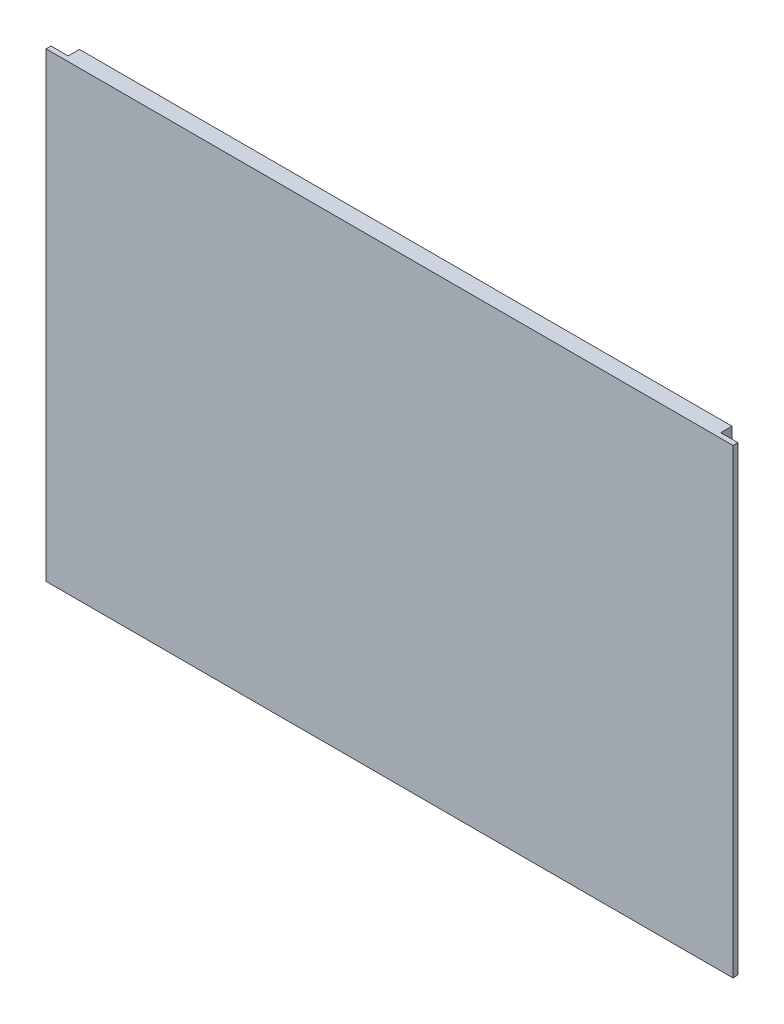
SolidWorks part; units mm, degrees
ref_plane "Ön Düzlem" through (0, 0, 0) normal (0, 0, 1) x (1, 0, 0)
ref_plane "Üst Düzlem" through (0, 0, 0) normal (0, 1, 0) x (1, 0, 0)
ref_plane "Sağ Düzlem" through (0, 0, 0) normal (1, 0, 0) x (0, 0, -1)
sketch "Çizim5" plane through (0, 0, 0) normal (0, 0, 1) x (1, 0, 0)
  line L1 (-78.6957, 40.8696) -> (61.3043, 40.8696)
  line L2 (-78.6957, 40.8696) -> (-78.6957, -53.1304)
  line L3 (-78.6957, -53.1304) -> (61.3043, -53.1304)
  line L4 (61.3043, 40.8696) -> (61.3043, -53.1304)
  dimension "D1" = 140
  dimension "D2" = 94
extrude "Yükseklik-Ekstrüzyon5" add sketch "Çizim5" against normal blind 1
sketch "Çizim7" plane through (-78.6957, 0, 0) normal (-1, 0, 0) x (0, 0, 1)
  line L5 (-1, -53.0304) -> (-3.3, -52.5304)
  line L6 (-1, 40.8696) -> (-1, -53.1304) construction
  line L7 (-3.3, -52.5304) -> (-3.3, -50.0304)
  line L8 (-3.3, -50.0304) -> (-1, -49.5304)
  line L9 (-1, -49.5304) -> (-1, -53.0304)
  line L10 (0, 40.8696) -> (0, -53.1304) construction
  dimension "D1" = 3.3
  dimension "D2" = 2.5
  dimension "D3" = 0.5
  dimension "D4" = 3.5
  dimension "D5" = 0.1
extrude "Yükseklik-Ekstrüzyon6" add sketch "Çizim7" against normal up to surface (140 mm away)
pattern_linear "LÇoğaltma1" count 16 spacing 6 along (0, 1, 0) of "Yükseklik-Ekstrüzyon6"
sketch "Çizim11" plane through (-78.6957, 0, 0) normal (-1, 0, 0) x (0, 0, 1)
  line L0 (0, 40.8696) -> (-3.3, 40.8696)
  line L1 (-3.3, 39.9696) -> (-3.3, 40.8696)
  line L2 (-3.3, 39.9696) -> (0, 39.9696)
  line L3 (0, 40.8696) -> (0, -53.1304) construction
  line L4 (0, 39.9696) -> (0, 40.8696)
extrude "Yükseklik-Ekstrüzyon7" add sketch "Çizim11" against normal up to surface (140 mm away)
sketch "Çizim12" plane through (-78.6957, 0, 0) normal (-1, 0, 0) x (0, 0, 1)
sketch "Çizim13" plane through (-78.6957, 0, 0) normal (-1, 0, 0) x (0, 0, 1)
  line L0 (-1, -53.0304) -> (1.243, -53.4093)
  line L2 (1.243, -53.4093) -> (-0.849, -53.5229)
  line L3 (-0.849, -53.5229) -> (-1, -53.0304)
extrude "Kes-Ekstrüzyon4" cut sketch "Çizim13" against normal up to surface (140 mm away)
sketch "Çizim14" plane through (-78.6957, 0, 0) normal (-1, 0, 0) x (0, 0, 1)
  line L0 (-3.3, 33.9696) -> (-7.4468, 33.9696)
  line L2 (-9.5, 33.4696) -> (-9.5, 32.4696)
  line L3 (-3.3, 31.4696) -> (-3.3, 33.9696)
  spline S0 degree 2 poles (-3.3, 31.4696) (-6.4753, 31.4753) (-9.5, 32.4696) knots 0 0 0 1 1 1
  spline S1 degree 2 poles (-9.5, 33.4696) (-8.5223, 33.9266) (-7.4468, 33.9696) knots 0 0 0 1 1 1
  dimension "D1" = 1
extrude "Yükseklik-Ekstrüzyon8" add sketch "Çizim14" against normal up to surface (140 mm away)
sketch "Çizim15" plane through (0, 33.9696, 0) normal (0, 1, 0) x (1, 0, 0)
  line L0 (-78.6957, 3.3) -> (-74.6957, 3.3)
  line L1 (61.3043, 3.3) -> (-78.6957, 3.3) construction
  line L8 (-78.6957, 9.5) -> (-62.6957, 9.5)
  line L9 (61.3043, 9.5) -> (-78.6957, 9.5) construction
  line L10 (-78.6957, 9.5) -> (-78.6957, 3.3)
  line L13 (61.3043, 2.8) -> (57.3043, 2.8)
  line L14 (61.3043, 9.5) -> (61.3043, 2.8)
  line L15 (61.3043, 9.5) -> (45.3043, 9.5)
  spline S0 degree 2 poles (-74.6957, 3.3) (-69.5753, 8.0052) (-62.6957, 9.5) knots 0 0 0 1 1 1
  spline S1 degree 2 poles (57.3043, 2.8) (52.4996, 8.1646) (45.3043, 9.5) knots 0 0 0 1 1 1
  dimension "D1" = 4
  dimension "D2" = 16
extrude "Kes-Ekstrüzyon7" cut sketch "Çizim15" against normal blind 3
sketch "Çizim17" plane through (0, 0, -3.3) normal (0, 0, -1) x (-1, 0, 0)
  line L0 (-61.3043, 40.8696) -> (-61.3043, -53.1304)
  line L1 (-61.3043, -53.1304) -> (-57.8043, -53.1304)
  line L2 (-61.3043, -53.1304) -> (78.6957, -53.1304) construction
  line L3 (-57.8043, -53.1304) -> (-57.8043, 44.5371)
  line L4 (-57.8043, 44.5371) -> (-61.3043, 44.5371)
  line L5 (-61.3043, 44.5371) -> (-61.3043, 40.8696)
  line L8 (78.6957, 44.5371) -> (78.6957, 40.8696)
  line L9 (75.1957, 44.5371) -> (78.6957, 44.5371)
  line L10 (75.1957, -53.1304) -> (75.1957, 44.5371)
  line L11 (78.6957, -53.1304) -> (75.1957, -53.1304)
  line L12 (78.6957, 40.8696) -> (78.6957, -53.1304)
  dimension "D1" = 3.5
  dimension "D2" = 3.5
  dimension "D3" = 0
extrude "Kes-Ekstrüzyon9" cut sketch "Çizim17" against normal up to surface (2.3 mm away)
